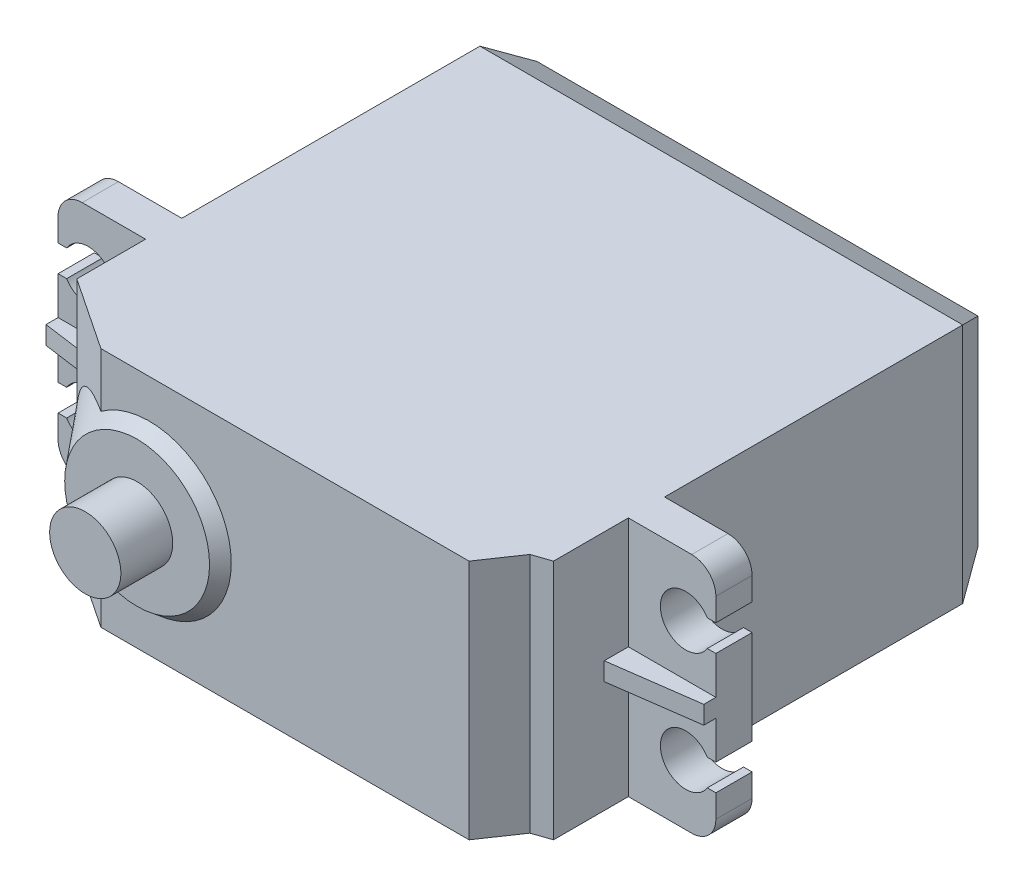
SolidWorks part; units mm, degrees
ref_plane "Plan de face" through (0, 0, 0) normal (0, 0, 1) x (1, 0, 0)
ref_plane "Plan de dessus" through (0, 0, 0) normal (0, 1, 0) x (1, 0, 0)
ref_plane "Plan de droite" through (0, 0, 0) normal (1, 0, 0) x (0, 0, -1)
sketch "Esquisse1" plane through (0, 0, 0) normal (0, 0, 1) x (1, 0, 0)
  line L1 (20, -10) -> (-20, -10)
  line L2 (20, -10) -> (20, 10)
  line L3 (20, 10) -> (-20, 10)
  line L4 (-20, -10) -> (-20, 10)
  line L5 (20, -10) -> (-20, 10) construction
  line L6 (20, 10) -> (-20, -10) construction
  point P0 (0, 0)
  dimension "D1" = 20
  dimension "D2" = 40
extrude "Boss.-Extru.1" add sketch "Esquisse1" along normal blind 40.4
ref_plane "Plan1" through (0, 0, 27.7) normal (0, 0, -1) x (-1, 0, 0)
sketch "Esquisse2" plane through (0, 0, 27.7) normal (0, 0, -1) x (-1, 0, 0)
  line L0 (-20, 0) -> (-31.0717, 0) construction
  line L1 (-20, 10) -> (-27.25, 10)
  line L2 (-20, 10) -> (-20, -10)
  line L3 (-20, -10) -> (-27.25, -10)
  line L4 (-27.25, 10) -> (-27.25, 6.1)
  line L5 (-24.75, 5) -> (-24.75, -5) construction
  line L6 (-27.25, 6.1) -> (-26.5389, 6.1)
  line L7 (-27.25, 3.9) -> (-26.5389, 3.9)
  line L8 (-27.25, -3.9) -> (-26.5389, -3.9)
  line L9 (-27.25, -6.1) -> (-26.5389, -6.1)
  line L10 (-27.25, 3.9) -> (-27.25, -3.9)
  line L11 (-27.25, -6.1) -> (-27.25, -10)
  line L12 (0, 0) -> (0, 16.2218) construction
  line L13 (20, -10) -> (27.25, -10)
  line L14 (27.25, -6.1) -> (27.25, -10)
  line L15 (27.25, -3.9) -> (26.5389, -3.9)
  line L16 (27.25, 3.9) -> (27.25, -3.9)
  line L17 (27.25, 3.9) -> (26.5389, 3.9)
  line L18 (27.25, 6.1) -> (26.5389, 6.1)
  line L19 (27.25, 10) -> (27.25, 6.1)
  line L20 (20, 10) -> (27.25, 10)
  line L21 (20, 10) -> (20, -10)
  line L22 (27.25, -6.1) -> (26.5389, -6.1)
  arc A0 (-26.5389, 3.9) -> (-26.5389, 6.1) centre (-24.75, 5) ccw
  arc A1 (-26.5389, -6.1) -> (-26.5389, -3.9) centre (-24.75, -5) ccw
  arc A2 (26.5389, -6.1) -> (26.5389, -3.9) centre (24.75, -5) cw
  arc A3 (26.5389, 3.9) -> (26.5389, 6.1) centre (24.75, 5) cw
  dimension "D3" = 10
  dimension "D4" = 4.75
  dimension "D5" = 4.2
  dimension "D6" = 4.2
  dimension "D1" = 7.25
  dimension "D2" = 5
  dimension "D7" = 2.2
  dimension "D8" = 1.1
  dimension "D9" = 1.1
  dimension "D10" = 2.2
extrude "Boss.-Extru.2" add sketch "Esquisse2" against normal blind 3
fillet "Congé1" radius 2 4 edges at (-27.25, 10, 29.2) (27.25, 10, 29.2) (-27.25, -10, 29.2) (27.25, -10, 29.2)
ref_plane "Plan2" through (0, 0, 0) normal (0, 1, 0) x (1, 0, 0)
sketch "Esquisse3" plane through (0, 0, 0) normal (0, 1, 0) x (1, 0, 0)
  line L0 (-27.25, -30.7) -> (-27.25, -31.7)
  line L1 (-27.25, -31.7) -> (-20, -32.7)
  line L3 (-20, -32.7) -> (-20, -30.7)
  line L4 (-20, -30.7) -> (-27.25, -30.7)
  line L5 (0, 0) -> (0, -16.7794) construction
  line L6 (27.25, -31.7) -> (20, -32.7)
  line L7 (20, -32.7) -> (20, -30.7)
  line L8 (20, -30.7) -> (27.25, -30.7)
  line L9 (27.25, -30.7) -> (27.25, -31.7)
  dimension "D1" = 2
  dimension "D2" = 1
extrude "Boss.-Extru.3" add sketch "Esquisse3" along normal blind 0.75 and the other way blind 0.75
chamfer "Chanfrein1" distance 3 angle 30 4 edges at (0, -10, 0) (20, 0, 0) (0, 10, 0) (-20, 0, 0)
chamfer "Chanfrein2" distance 4 distance2 6 1 edges at (-20, 0, 40.4)
sketch "Esquisse4" plane through (0, -10, 0) normal (0, -1, 0) x (1, 0, 0)
  line L0 (16.5, 40.4) -> (18.54, 37.4)
  line L1 (-14, 40.4) -> (20, 40.4) construction
  line L2 (18.54, 37.4) -> (20, 36.9)
  line L3 (20, 40.4) -> (20, 30.7) construction
  line L4 (16.5, 40.4) -> (20, 40.4)
  line L5 (20, 40.4) -> (20, 36.9)
  dimension "D1" = 3.5
  dimension "D2" = 3
  dimension "D3" = 3.5
extrude "Enlèv. mat.-Extru.1" cut sketch "Esquisse4" against normal through all
sketch "Esquisse5" plane through (0, 0, 0) normal (0, 1, 0) x (1, 0, 0)
  line L0 (-10, -41.63) -> (-10, -35.9487) construction
  line L1 (-20, -36.4) -> (-20, -30.7) construction
  line L2 (-10, -41.4) -> (-16, -41.4)
  line L3 (-16, -41.4) -> (-20, -36.4)
  line L4 (-20, -36.4) -> (-10, -36.4)
  line L5 (-10, -36.4) -> (-10, -41.4)
  line L6 (-14, -40.4) -> (16.5, -40.4) construction
  dimension "D1" = 10
  dimension "D2" = 1
  dimension "D3" = 6
revolve "Révolution1" add sketch "Esquisse5" angle 360 about L0
sketch "Esquisse6" plane through (0, 0, 41.4) normal (0, 0, 1) x (1, 0, 0)
  circle A0 centre (-10, 0) radius 2.95
  dimension "D1" = 5.9
extrude "Boss.-Extru.4" add sketch "Esquisse6" along normal blind 4.3
equation "\"D6@Esquisse2\"=\"D5@Esquisse2\""
